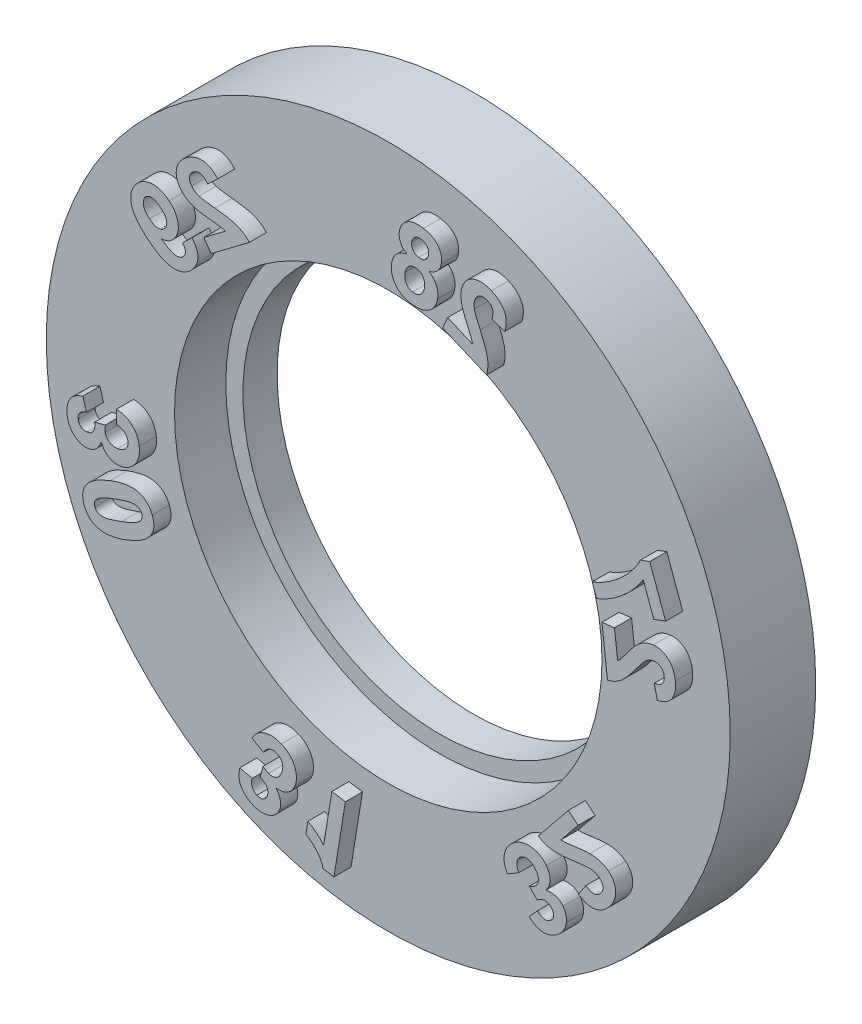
SolidWorks part; units mm, degrees
ref_plane "Front Plane" through (0, 0, 0) normal (0, 0, 1) x (1, 0, 0)
ref_plane "Top Plane" through (0, 0, 0) normal (0, 1, 0) x (1, 0, 0)
ref_plane "Right Plane" through (0, 0, 0) normal (1, 0, 0) x (0, 0, -1)
imported_body "Imported1"
other "DeleteFace2"
sketch "Sketch2" plane through (0, 0, 0) normal (0, 0, 1) x (1, 0, 0)
  line L2 (0, 0) -> (0, 21.375) construction
  line L3 (0, 0) -> (18.5113, 10.6875) construction
  line L4 (0, 0) -> (18.5113, -10.6875) construction
  line L5 (0, 0) -> (0, -21.375) construction
  line L6 (0, 0) -> (-18.5113, -10.6875) construction
  line L7 (0, 0) -> (-18.5113, 10.6875) construction
  circle A0 centre (0, 0) radius 13.8372 construction
  text T0 "27     28     29     30     31     32" font "Arial" height 4.2
  point P11 (0, 0)
  dimension "D1" = 6
extrude "Boss-Extrude1" add sketch "Sketch2" along normal blind 1
